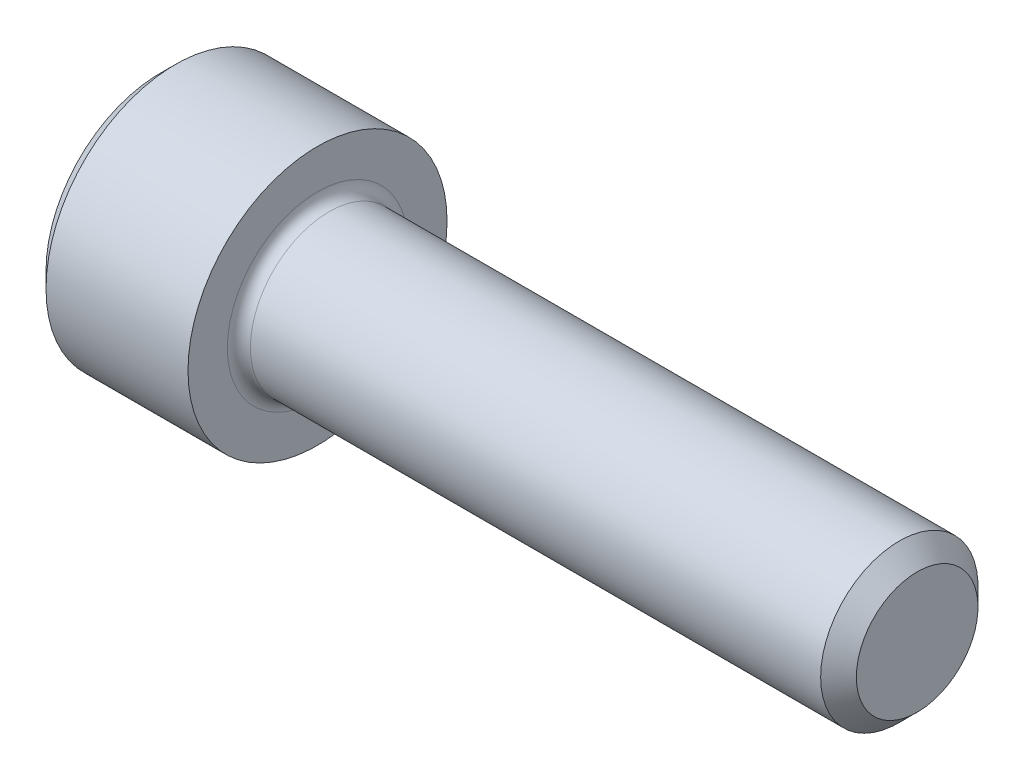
SolidWorks part; units mm, degrees
revolve "Base-Revolve" add sketch "BodySke"
sketch "BodySke" plane through (0, 0, 0) normal (0, 0, 1) x (1, 0, 0)
  line L0 (0, 0) -> (0, 3.0226)
  line L1 (0.4064, 3.429) -> (4.1656, 3.429)
  line L2 (4.1656, 3.429) -> (4.1656, 2.0828)
  line L3 (4.1656, 2.0828) -> (19.5682, 2.0828)
  line L4 (20.0406, 1.6104) -> (20.0406, 0)
  line L5 (20.0406, 0) -> (0, 0)
  line L6 (-31.75, 0) -> (127, 0) construction
  line L7 (0, 3.0226) -> (0.4064, 3.429)
  line L8 (20.0406, 1.6104) -> (19.5682, 2.0828)
  line L9 (0, -3.0226) -> (0.4064, -3.429) construction
  line L10 (20.0406, -1.6104) -> (19.5682, -2.0828) construction
  line L11 (4.9581, 9.525) -> (4.9581, 3.175) construction
  line L12 (4.1656, 9.525) -> (4.1656, 3.175) construction
  line L13 (-18.0594, 9.525) -> (-18.0594, 3.175) construction
  dimension "Diameter" = 4.1656
  dimension "Head_ht" = 4.1656
  dimension "Length" = 15.875
  dimension "Body_ch_ang" = 45
  dimension "Head_dia" = 6.858
  dimension "Head_ch_ang" = 45
  dimension "Head_side_ht" = 3.7592
  dimension "Minor_dia" = 3.2207
  dimension "Advance" = 0.7925
  dimension "Thread_nom" = 15.875
  dimension "Thread_length" = 38.1
fillet "Fillet1" radius 0.3048 1 edges at (4.1656, 0, 2.0828)
ref_plane "Plane1" through (0, 0, 0) normal (0, 0, 1) x (1, 0, 0)
ref_plane "Plane2" through (0, 0, 0) normal (0, 1, 0) x (1, 0, 0)
ref_plane "Plane3" through (0, 0, 0) normal (1, 0, 0) x (0, 0, -1)
sketch "Sketch2" plane through (0, 0, 0) normal (0, 0, 1) x (1, 0, 0)
  line L0 (0, 1.778) -> (1.9558, 1.778)
  line L1 (1.9558, 1.778) -> (2.9823, 0)
  line L2 (-31.75, 0) -> (127, 0) construction
  line L3 (2.9823, 0) -> (0, 0)
  line L4 (0, 0) -> (0, 1.778)
  line L5 (0, 3.0226) -> (0, -3.0226) construction
  line L6 (0, 0) -> (47.625, 0) construction
  line L7 (4.1656, -3.429) -> (4.1656, 3.429) construction
revolve "Hex-PreBroach" cut sketch "Sketch2" angle 360 about L6
sketch "Sketch3" plane through (0, 0, 0) normal (-1, 0, 0) x (0, 0.5, 0.866)
  line L0 (1.0265, 1.778) -> (-1.0265, 1.778)
  line L1 (-1.0265, 1.778) -> (-2.0531, 0)
  line L2 (1.0265, 1.778) -> (2.0531, 0)
  line L3 (1.0265, -1.778) -> (2.0531, 0)
  line L4 (1.0265, -1.778) -> (-1.0265, -1.778)
  line L5 (-1.0265, -1.778) -> (-2.0531, 0)
extrude "Hex" cut sketch "Sketch3" against normal blind 1.9558
sketch "Sketch4" plane through (0, 0, 0) normal (-1, 0, 0) x (0, 0, 1)
  line L0 (0, 0) -> (2.1971, 0)
  line L1 (0, 0) -> (6.1484, 3.5498) construction
  line L2 (0, 0) -> (1.0985, 1.9027)
  line L3 (1.8302, 0.5287) -> (2.0897, 0.6786)
  line L4 (1.373, 1.3206) -> (1.6325, 1.4704)
  arc A0 (1.8302, 0.5287) -> (1.373, 1.3206) centre (0, 0) ccw
  arc A1 (2.1971, 0) -> (2.0897, 0.6786) centre (0, 0) ccw
  arc A2 (1.0985, 1.9027) -> (1.6325, 1.4704) centre (0, 0) cw
extrude "Spline" [suppressed] cut sketch "Sketch4" against normal blind 1.9558
pattern_circular "CirPattern1" [suppressed] count 6 every 60
sketch "Sketch5" plane through (0, 0, 0) normal (0, 0, 1) x (1, 0, 0)
  line L0 (-31.75, 0) -> (127, 0) construction
  line L2 (0, 3.0226) -> (0, -3.0226) construction
  circle A0 centre (1.524, 0) radius 0.5905
  dimension "Drilled_hole_dia" = 1.1811
  dimension "Drilled_hole_loc" = 1.524
extrude "Hole" [suppressed] cut sketch "Sketch5" against normal through all and the other way through all
pattern_circular "Drilled-4" [suppressed] count 2 every 60
pattern_circular "Drilled-6" [suppressed] count 3 every 60
sketch "ThdSchSke" plane through (0, 0, 0) normal (0, 0, 1) x (1, 0, 0)
  line L0 (4.9581, -1.6104) -> (4.6273, -2.0828)
  line L1 (4.9581, -1.6104) -> (5.2889, -2.0828)
  line L2 (5.2889, -2.0828) -> (5.2889, -2.6035)
  line L3 (-3.175, 0) -> (5.1513, 0) construction
  line L5 (5.2889, -2.6035) -> (4.6273, -2.6035)
  line L6 (4.6273, -2.6035) -> (4.6273, -2.0828)
  line L7 (0, 3.0226) -> (0, -3.0226) construction
revolve "ThreadSchematic" [suppressed] cut sketch "ThdSchSke" angle 360 about L3
pattern_linear "ThdSchPat" [suppressed]
equation "\"D2@Sketch3\" = \"Hex_size@Sketch3\" / 2"
equation "\"D1@Sketch3\" = \"Hex_size@Sketch3\" / 2"
equation "\"D1@Sketch2\" = \"Hex_size@Sketch3\" / 2"
equation "\"D3@Sketch4\" = \"Spline_p_dim@Sketch4\" / 2"
equation "\"Thread_minor@ThreadCosmetic\"  =  \"Minor_dia@BodySke\""
equation "\"D2@CirPattern1\" = 360 / \"Num_teeth@CirPattern1\""
equation "\"Wall_thickness@Sketch2\" = \"Head_ht@BodySke\" - \"Key_eng@Hex\""
equation "\"Thread_length@ThreadCosmetic\" = ((sgn( (\"Length@BodySke\" - \"Advance@BodySke\" ) - \"Thread_nom@BodySke\" )-1)*( (\"Length@BodySke\" - \"Advance@BodySke\" ) - \"Thread_nom@BodySke\" ))/-2+ \"Thread_nom@BodySke\""
equation "\"Thread_minor@ThdSchSke\" = \"Minor_dia@BodySke\""
equation "\"Diameter@ThdSchSke\" = \"Diameter@BodySke\""
equation "\"Overcut@ThdSchSke\" = \"Diameter@BodySke\" * 1.25"
equation "\"Start@ThdSchSke\" = \"Head_ht@BodySke\" + \"Length@BodySke\" - \"Thread_length@ThreadCosmetic\"  '---Non-countersunk---"
equation "\"Num_threads@ThdSchPat\" = int( \"Thread_length@ThreadCosmetic\" / \"Advance@BodySke\" + 0.999 )  + 1"
equation "\"Advance@ThdSchPat\" = \"Thread_length@ThreadCosmetic\" /  (\"Num_threads@ThdSchPat\" - 1) 'relax it"
equation "\"Num_threads@ThdSchPat\" = \"Num_threads@ThdSchPat\" - sgn( \"Num_threads@ThdSchPat\" - 1) '---chamfered tips only---"
